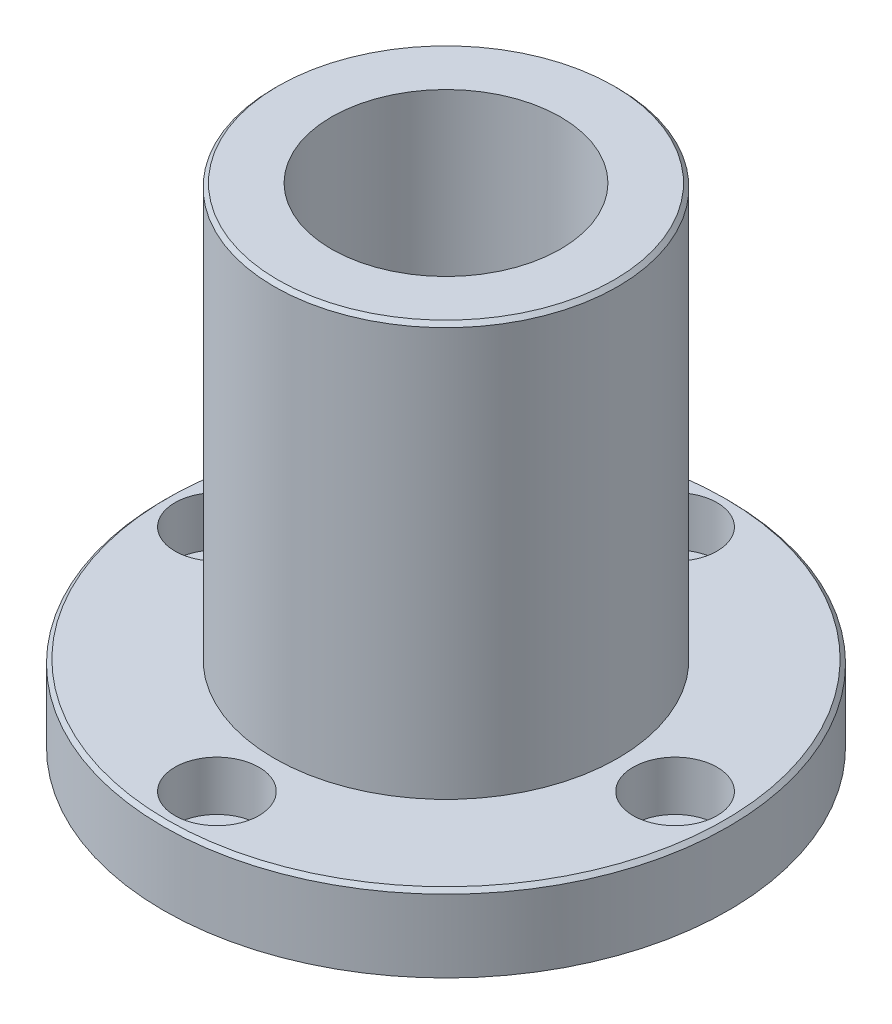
SolidWorks part; units mm, degrees
other "Solid1"
ref_plane "Front Plane" through (0, 0, 0) normal (0, 0, 1) x (1, 0, 0)
ref_plane "Top Plane" through (0, 0, 0) normal (0, 1, 0) x (1, 0, 0)
ref_plane "Right Plane" through (0, 0, 0) normal (1, 0, 0) x (0, 0, -1)
imported_body "2.7038 LMF30.stp<1>"
sketch "Sketch1" plane through (0, 10, 0) normal (0, 1, 0) x (1, 0, 0)
  circle A0 centre (0, 0) radius 37
  circle A1 centre (0, 0) radius 40.5696
  dimension "D1" = 74
extrude "Cut-Extrude1" cut sketch "Sketch1" against normal through all
chamfer "Chamfer1" distance 0.5 angle 45 1 edges at (0, 10, -37)
